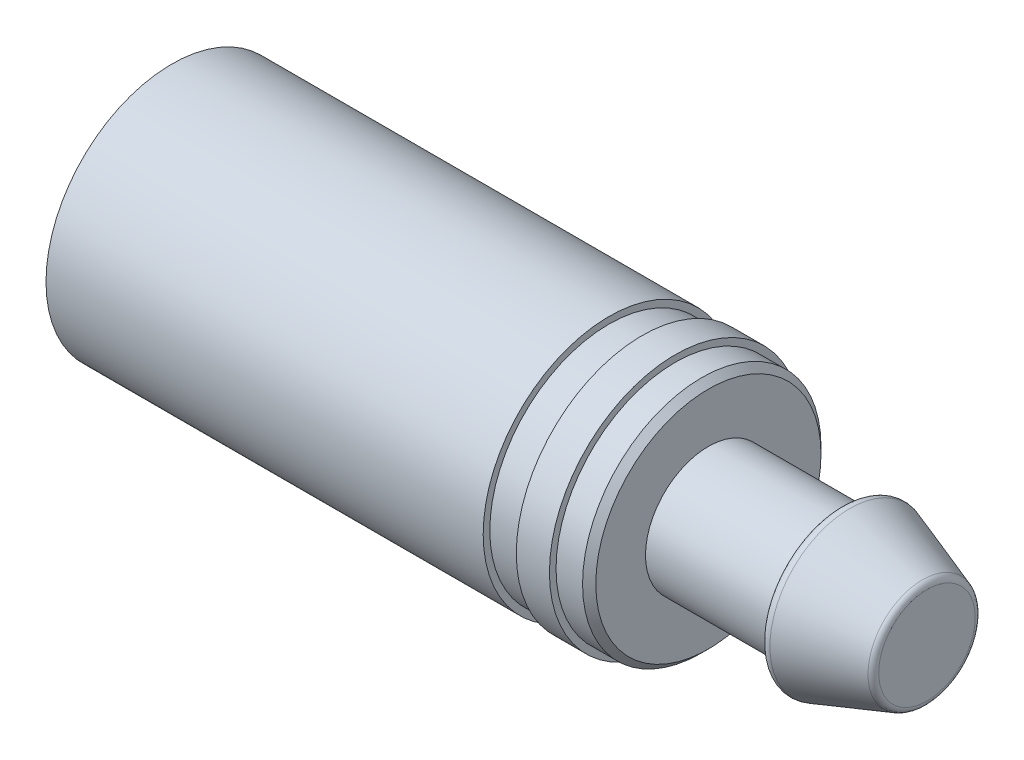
SolidWorks part; units mm, degrees
ref_plane "Alzado" through (0, 0, 0) normal (0, 0, 1) x (1, 0, 0)
ref_plane "Planta" through (0, 0, 0) normal (0, 1, 0) x (1, 0, 0)
ref_plane "Vista lateral" through (0, 0, 0) normal (1, 0, 0) x (0, 0, -1)
sketch "Croquis1" plane through (0, 0, 0) normal (0, 0, 1) x (1, 0, 0)
  line L0 (0, 0) -> (36.1529, 0) construction
  line L1 (0, 0) -> (0, 19)
  line L2 (0, 19) -> (66, 19)
  line L3 (66, 19) -> (66, 18)
  line L4 (66, 18) -> (71, 18)
  line L5 (71, 18) -> (71, 19)
  line L6 (71, 19) -> (76, 19)
  line L7 (76, 19) -> (76, 18)
  line L8 (76, 18) -> (81, 18)
  line L9 (81, 18) -> (81, 9.5)
  line L10 (81, 9.5) -> (101, 9.5)
  line L11 (101, 9.5) -> (101, 12.5)
  line L12 (101, 12.5) -> (114, 8)
  line L15 (0, 0) -> (114, 0)
  line L16 (114, 0) -> (114, 8)
  dimension "D1" = 38
  dimension "D2" = 66
  dimension "D3" = 1
  dimension "D4" = 5
  dimension "D5" = 5
  dimension "D6" = 5
  dimension "D7" = 19
  dimension "D8" = 20
  dimension "D9" = 16
  dimension "D10" = 33
  dimension "D11" = 25
revolve "Revolución1" add sketch "Croquis1" angle 360 about L0
fillet "Redondeo1" radius 1 2 edges at (114, 0, 8) (101, 0, 12.5)
chamfer "Chaflán1" distance 1 angle 45 1 edges at (81, 0, 18)
